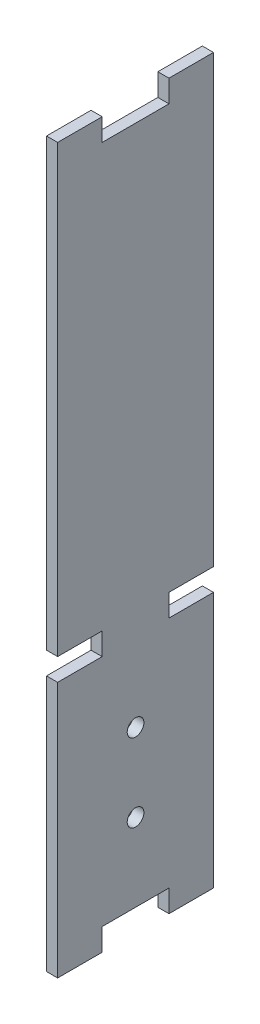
SolidWorks part; units mm, degrees
ref_plane "Front" through (0, 0, 0) normal (0, 0, 1) x (1, 0, 0)
ref_plane "Top" through (0, 0, 0) normal (0, 1, 0) x (1, 0, 0)
ref_plane "Right" through (0, 0, 0) normal (1, 0, 0) x (0, 0, -1)
sketch "Sketch1" plane through (0, 0, 0) normal (1, 0, 0) x (0, 0, -1)
  line L0 (-9.525, 0) -> (9.525, 0)
  line L1 (-9.525, 0) -> (-9.525, -6.35)
  line L2 (-9.525, -6.35) -> (-22.225, -6.35)
  line L3 (-22.225, -6.35) -> (-22.225, 66.675)
  line L4 (-22.225, 66.675) -> (-9.525, 66.675)
  line L5 (-9.525, 66.675) -> (-9.525, 73.025)
  line L6 (-9.525, 73.025) -> (-22.225, 73.025)
  line L7 (-22.225, 73.025) -> (-22.225, 200.025)
  line L8 (-22.225, 200.025) -> (-9.525, 200.025)
  line L9 (0, -1000) -> (0, 49000) construction
  line L10 (9.525, 200.025) -> (9.525, 193.675)
  line L11 (22.225, 200.025) -> (9.525, 200.025)
  line L12 (22.225, 73.025) -> (22.225, 200.025)
  line L13 (-9.525, 200.025) -> (-9.525, 193.675)
  line L14 (-9.525, 193.675) -> (9.525, 193.675)
  line L15 (9.525, 73.025) -> (22.225, 73.025)
  line L16 (9.525, 66.675) -> (9.525, 73.025)
  line L17 (22.225, 66.675) -> (9.525, 66.675)
  line L18 (22.225, -6.35) -> (22.225, 66.675)
  line L19 (9.525, -6.35) -> (22.225, -6.35)
  line L20 (9.525, 0) -> (9.525, -6.35)
  circle A0 centre (0, 44.45) radius 2.3812
  circle A1 centre (0, 22.225) radius 2.3813
  dimension "D6" = 4.7625
  dimension "D1" = 6.35
  dimension "D2" = 12.7
  dimension "D3" = 66.675
  dimension "D4" = 120.65
  dimension "D5" = 19.05
  dimension "D7" = 22.225
  dimension "D8" = 22.225
extrude "Extrude1" add sketch "Sketch1" along normal blind 3.175
